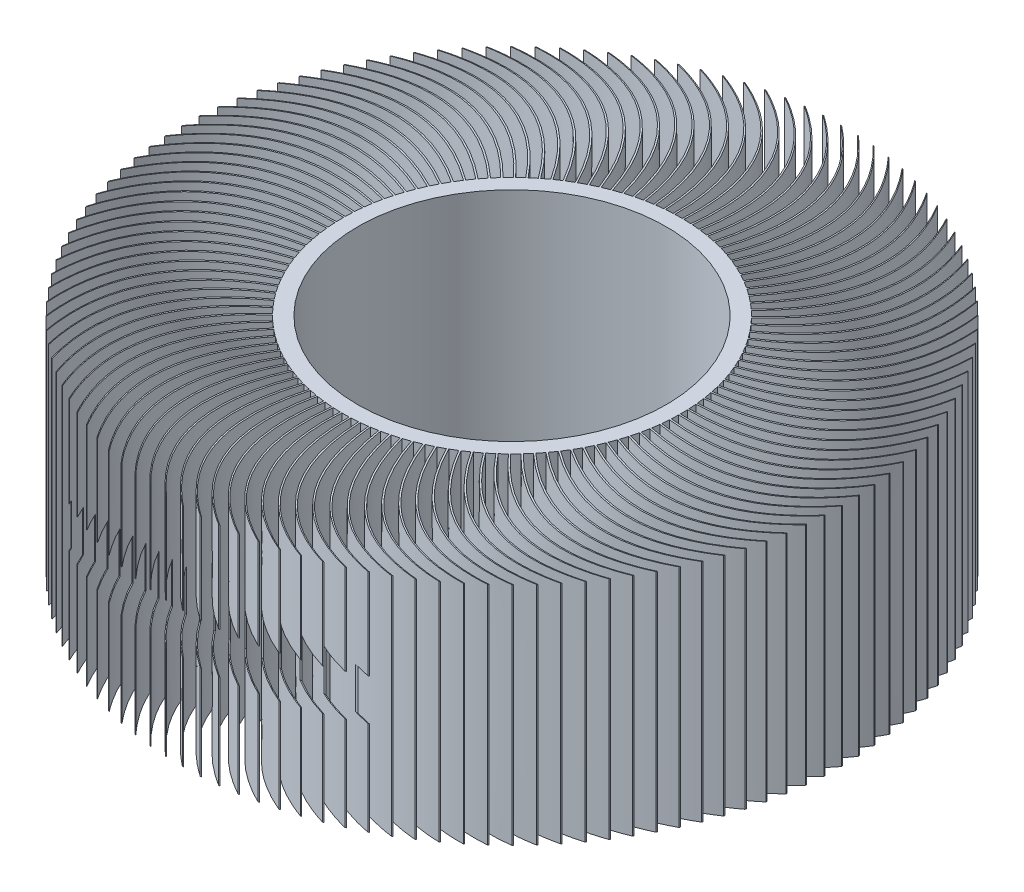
SolidWorks part; units mm, degrees
ref_plane "Front Plane" through (0, 0, 0) normal (0, 0, 1) x (1, 0, 0)
ref_plane "Top Plane" through (0, 0, 0) normal (0, 1, 0) x (1, 0, 0)
ref_plane "Right Plane" through (0, 0, 0) normal (1, 0, 0) x (0, 0, -1)
sketch "Sketch1" plane through (0, 0, 0) normal (0, 1, 0) x (1, 0, 0)
  circle A0 centre (0, 0) radius 20.5
  circle A1 centre (0, 0) radius 22.5
  dimension "D1" = 41
  dimension "D2" = 2
extrude "Boss-Extrude1" add sketch "Sketch1" along normal blind 30
ref_plane "Plane1" through (21, 0, 0) normal (1, 0, 0) x (0, 0, -1)
sketch "Sketch2" plane through (21, 0, 0) normal (1, 0, 0) x (0, 0, -1)
  line L0 (22.5, 30) -> (-22.5, 30) construction
  line L1 (-0.22, 30) -> (0, 30)
  line L2 (-0.22, 30) -> (-0.22, 0)
  line L3 (-0.22, 0) -> (0, 0)
  line L4 (0, 30) -> (0, 0)
  dimension "D1" = 0.22
ref_plane "Plane2" through (43, 0, 0) normal (1, 0, 0) x (0, 0, -1)
sketch "Sketch3" plane through (43, 0, 0) normal (1, 0, 0) x (0, 0, -1)
  line L8 (13.1737, 0) -> (13.3937, 0)
  line L9 (13.1737, 30) -> (13.3937, 30)
  line L10 (13.1737, 30) -> (13.1737, 0)
  line L11 (13.3937, 30) -> (13.3937, 0)
  line L12 (22.5, 30) -> (-22.5, 30) construction
sketch3d "3DSketch1"
  spline S0 degree 2 poles (21, 30, 0) (37.8554, 30, 1.7004) (43, 30, -13.3937) knots 0 0 0 1 1 1
loft "Loft1" add profiles "Sketch2", "Sketch3"
pattern_circular "CirPattern12" count 120 over 360 of "Loft1"
ref_plane "Plane3" through (0, 0, 62) normal (0, 0, 1) x (1, 0, 0)
sketch "Sketch4" plane through (0, 0, 62) normal (0, 0, 1) x (1, 0, 0)
  line L1 (-26.1833, 18) -> (25.8167, 18)
  line L2 (-26.1833, 18) -> (-26.1833, 12.5)
  line L3 (-26.1833, 12.5) -> (25.8167, 12.5)
  line L4 (25.8167, 18) -> (25.8167, 12.5)
  line L5 (25.8167, 30) -> (25.8167, 0) construction
  dimension "D1" = 52
  dimension "D2" = 12
  dimension "D3" = 5.5
extrude "Cut-Extrude1" cut sketch "Sketch4" against normal blind 23.5
mirror "Mirror1" about plane through (0, 0, 0) normal (0, 0, 1) of "Cut-Extrude1"
sketch "Sketch5" plane through (0, 30, 0) normal (0, 1, 0) x (1, 0, 0)
  circle A0 centre (0, 0) radius 43.795
  circle A1 centre (0, 0) radius 46.2021
extrude "Cut-Extrude2" cut sketch "Sketch5" against normal through all
